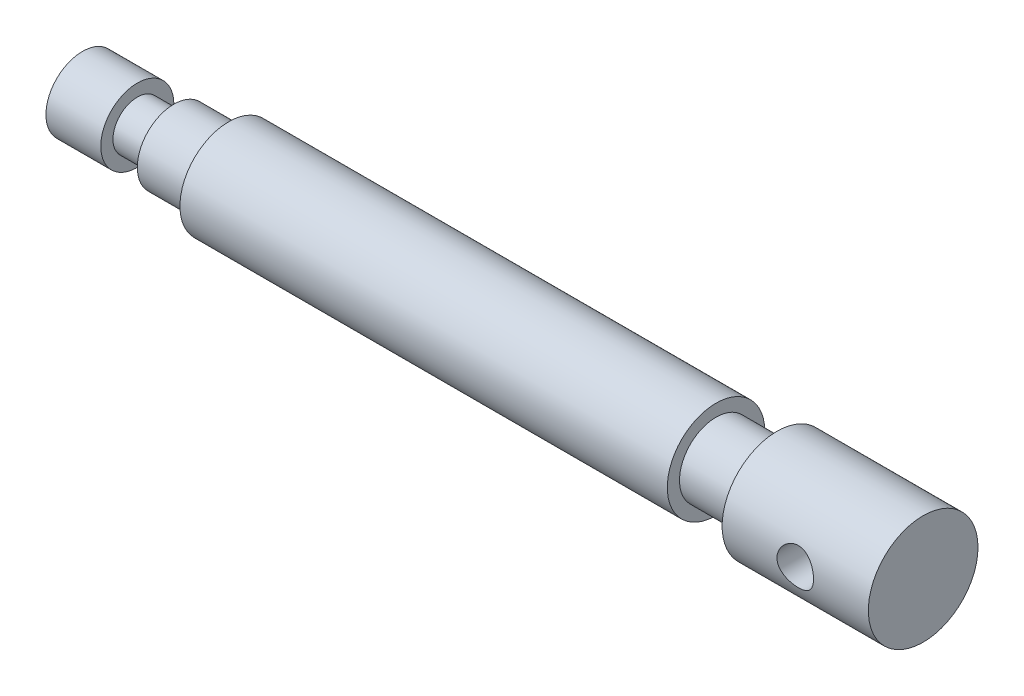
SolidWorks part; units mm, degrees
ref_plane "Front Plane" through (0, 0, 0) normal (0, 0, 1) x (1, 0, 0)
ref_plane "Top Plane" through (0, 0, 0) normal (0, 1, 0) x (1, 0, 0)
ref_plane "Right Plane" through (0, 0, 0) normal (1, 0, 0) x (0, 0, -1)
sketch "Sketch1" plane through (0, 0, 0) normal (0, 0, 1) x (1, 0, 0)
  line L0 (0, 0) -> (0, 6)
  line L1 (0, 6) -> (9, 6)
  line L2 (9, 6) -> (9, 4)
  line L3 (9, 4) -> (15, 4)
  line L4 (15, 4) -> (15, 6)
  line L5 (15, 6) -> (24, 6)
  line L6 (24, 6) -> (24, 8)
  line L7 (24, 8) -> (104, 8)
  line L8 (104, 8) -> (104, 6)
  line L9 (104, 6) -> (114, 6)
  line L10 (114, 6) -> (114, 9)
  line L11 (114, 9) -> (138, 9)
  line L12 (138, 9) -> (138, 0)
  line L13 (138, 0) -> (0, 0)
  line L14 (0, 0) -> (-5.6418, 0) construction
  dimension "D1" = 12
  dimension "D2" = 8
  dimension "D3" = 16
  dimension "D4" = 9
  dimension "D5" = 6
  dimension "D6" = 80
  dimension "D7" = 10
  dimension "D8" = 24
  dimension "D9" = 18
  dimension "D10" = 138
revolve "Revolve1" add sketch "Sketch1" angle 360 about L14
sketch "Sketch2" plane through (0, 0, 0) normal (0, 0, 1) x (1, 0, 0)
  circle A0 centre (126, 0) radius 3
  dimension "D2" = 6
  dimension "D1" = 12
extrude "Cut-Extrude1" cut sketch "Sketch2" against normal mid plane 20
